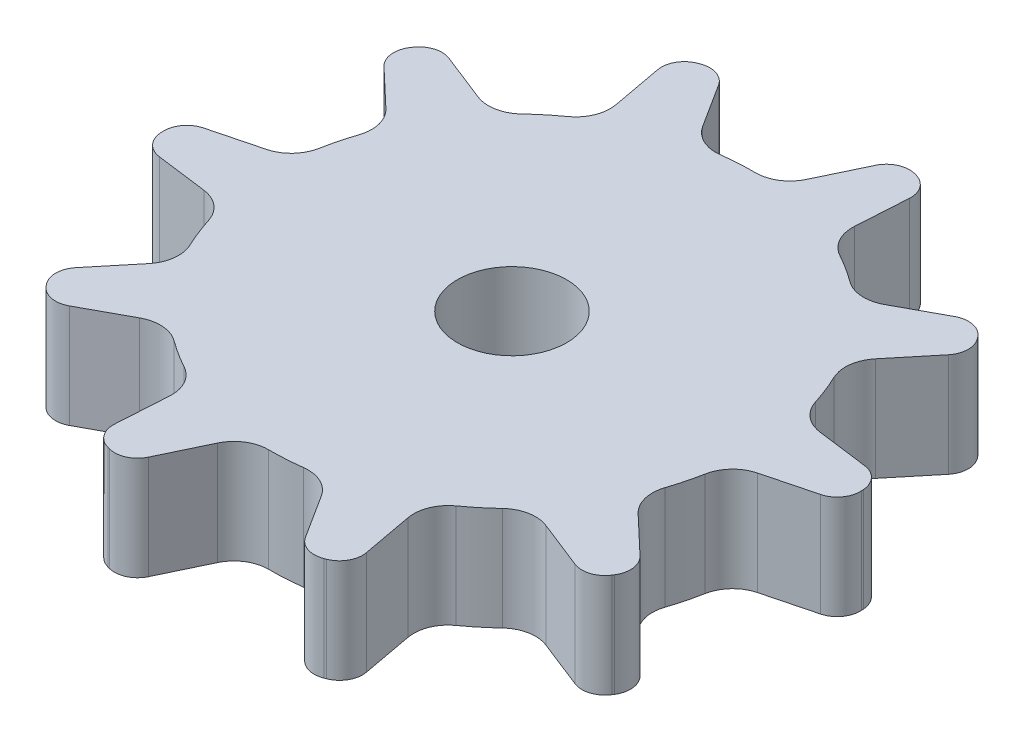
SolidWorks part; units mm, degrees
ref_plane "Front Plane" through (0, 0, 0) normal (0, 0, 1) x (1, 0, 0)
ref_plane "Top Plane" through (0, 0, 0) normal (0, 1, 0) x (1, 0, 0)
ref_plane "Right Plane" through (0, 0, 0) normal (1, 0, 0) x (0, 0, -1)
body saved out of another part "Stock-Cogs-1"
